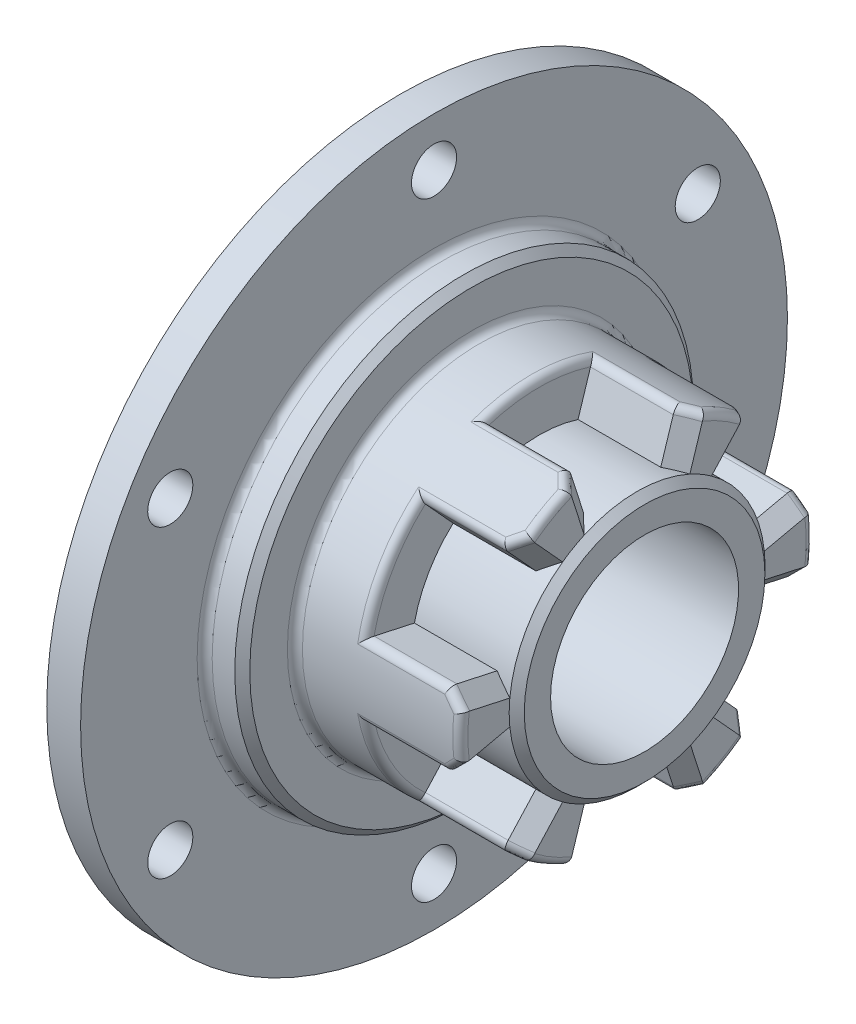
SolidWorks part; units mm, degrees
ref_plane "Front Plane" through (0, 0, 0) normal (0, 0, 1) x (1, 0, 0)
ref_plane "Top Plane" through (0, 0, 0) normal (0, 1, 0) x (1, 0, 0)
ref_plane "Right Plane" through (0, 0, 0) normal (1, 0, 0) x (0, 0, -1)
sketch "Sketch1" plane through (0, 0, 0) normal (0, 0, 1) x (1, 0, 0)
  line L0 (0, 34) -> (0, 47)
  line L1 (0, 47) -> (4.5, 47)
  line L2 (4.5, 47) -> (4.5, 30.5)
  line L3 (4.5, 30.5) -> (9.5, 30.5)
  line L4 (9.5, 30.5) -> (9.5, 23.5)
  line L5 (9.5, 23.5) -> (31.5, 23.5)
  line L6 (31.5, 23.5) -> (31.5, 17)
  line L7 (31.5, 17) -> (32.5, 17)
  line L8 (32.5, 17) -> (32.5, 12.5)
  line L9 (32.5, 12.5) -> (9, 12.5)
  line L10 (9, 12.5) -> (9, 14.5)
  line L11 (9, 14.5) -> (4.5, 14.5)
  line L12 (4.5, 14.5) -> (4.5, 27.7695)
  line L13 (4.5, 27.7695) -> (-3.5, 31.5)
  line L14 (-3.5, 31.5) -> (-3.5, 34)
  line L15 (-3.5, 34) -> (0, 34)
  line L16 (0, 0) -> (43.8293, 0) construction
  dimension "D1" = 4.5
  dimension "D2" = 47
  dimension "D3" = 34
  dimension "D4" = 2.5
  dimension "D5" = 115
  dimension "D6" = 3.5
  dimension "D7" = 5
  dimension "D8" = 4.5
  dimension "D9" = 14.5
  dimension "D10" = 6.5
  dimension "D11" = 7
  dimension "D12" = 4.5
  dimension "D13" = 1
  dimension "D14" = 2
  dimension "D15" = 22
revolve "Revolve1" add sketch "Sketch1" angle 360 about L16
sketch "Sketch2" plane through (31.5, 0, 0) normal (1, 0, 0) x (0, 0, -1)
  line L0 (-11.8039, 37.1206) -> (0, 0) construction
  line L1 (0, 0) -> (11.8039, 37.1206) construction
  line L2 (11.8039, 37.1206) -> (0, 37.1206) construction
  line L3 (0, 37.1206) -> (0, 0) construction
  line L4 (-7.1213, 22.395) -> (-5.1516, 16.2006)
  line L5 (7.1213, 22.395) -> (5.1516, 16.2006)
  arc A0 (-5.1516, 16.2006) -> (5.1516, 16.2006) centre (0, 0) cw
  circle A1 centre (0, 0) radius 17 construction
  arc A2 (-7.1213, 22.395) -> (7.1213, 22.395) centre (0, 0) cw
  circle A3 centre (0, 0) radius 23.5 construction
  circle A4 centre (0, 0) radius 23.5 construction
  circle A5 centre (0, 0) radius 17 construction
  dimension "D1" = 35.28
extrude "Cut-Extrude1" cut sketch "Sketch2" against normal blind 13
sketch "Sketch3" plane through (4.5, 0, 0) normal (1, 0, 0) x (0, 0, -1)
  circle A0 centre (0, 40.5) radius 3
  dimension "D1" = 6
  dimension "D2" = 40.5
extrude "Cut-Extrude2" cut sketch "Sketch3" against normal through all
pattern_circular "CirPattern1" count 6 over 360 about axis through (0, 0, 0) along (1, 0, 0) of "Cut-Extrude1", "Cut-Extrude2"
fillet "Fillet1" radius 1 2 edges at (9.5, 0, 23.5) (4.5, 0, 30.5)
chamfer "Chamfer1" distance 1 angle 45 4 edges at (32.5, 0, 17) (9.5, 0, 30.5) (9, 0, 12.5) (4.5, 0, 14.5)
chamfer "Chamfer2" distance 2 angle 45 12 edges at (31.5, -14.9632, 13.6442) (31.5, -19.2978, 6.1365) (31.5, -19.2978, -6.1365) (31.5, -14.9632, -13.6442) (31.5, -4.3346, -19.7806) (31.5, 4.3346, -19.7806) (31.5, 14.9632, -13.6442) (31.5, 19.2978, -6.1365) (31.5, 19.2978, 6.1365) (31.5, 14.9632, 13.6442) (31.5, 4.3346, 19.7806) (31.5, -4.3346, 19.7806)
chamfer "Chamfer3" distance 0.75 angle 45 2 edges at (4.5, 0, 27.7695) (-3.5, 0, 31.5)
fillet "Fillet2" radius 1 36 edges at (30.5009, -22.0714, 8.0687) (24, -22.395, 7.1213) (18.5, -23.5, 0) (24, -22.395, -7.1213) (30.5009, -22.0714, -8.0687) (31.5, -20.3516, -11.75) (30.5009, -18.0234, -15.08) (24, -17.3648, -15.834) (18.5, -11.75, -20.3516) (24, -5.0303, -22.9553) (30.5009, -4.048, -23.1487) (31.5, 0, -23.5) (30.5009, 4.048, -23.1487) (24, 5.0303, -22.9553) (18.5, 11.75, -20.3516) (24, 17.3648, -15.834) (30.5009, 18.0234, -15.08) (31.5, 20.3516, -11.75) (30.5009, 22.0714, -8.0687) (24, 22.395, -7.1213) (18.5, 23.5, 0) (24, 22.395, 7.1213) (30.5009, 22.0714, 8.0687) (31.5, 20.3516, 11.75) (30.5009, 18.0234, 15.08) (24, 17.3648, 15.834) (18.5, 11.75, 20.3516) (24, 5.0303, 22.9553) (30.5009, 4.048, 23.1487) (31.5, 0, 23.5) (30.5009, -4.048, 23.1487) (24, -5.0303, 22.9553) (18.5, -11.75, 20.3516) (24, -17.3648, 15.834) (30.5009, -18.0234, 15.08) (31.5, -20.3516, 11.75)
